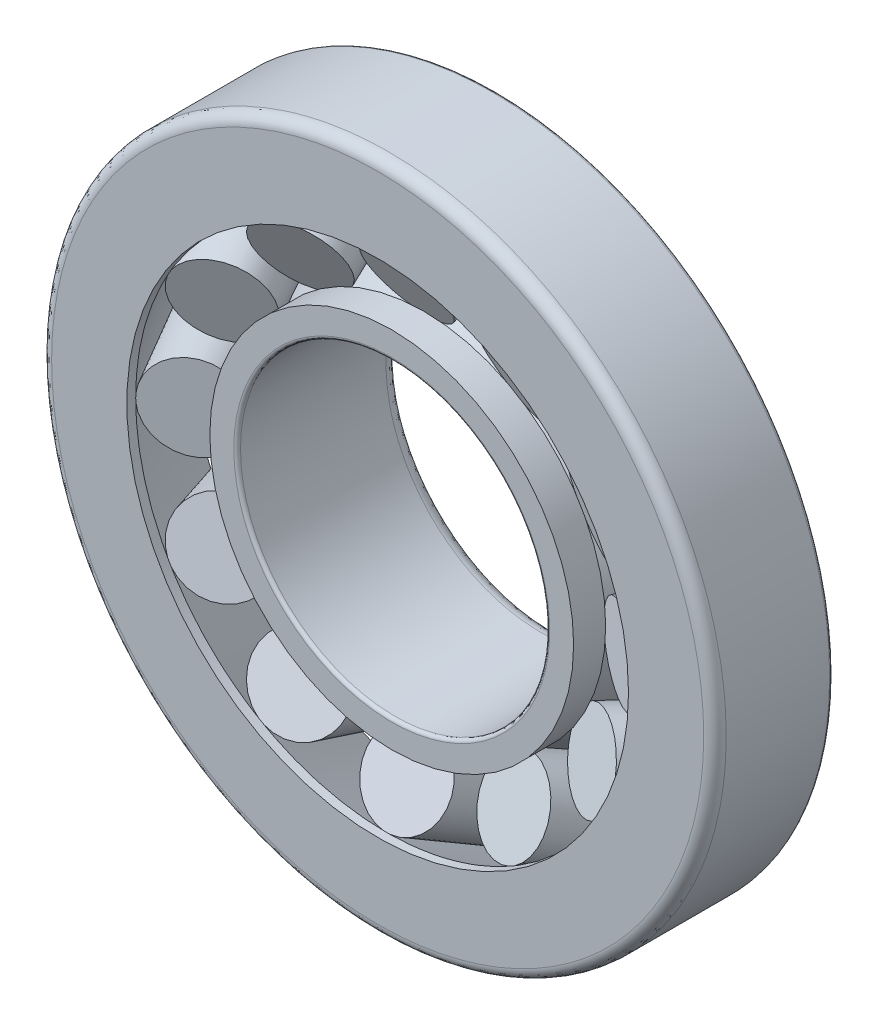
SolidWorks part; units mm, degrees
ref_plane "Front Plane" through (0, 0, 0) normal (0, 0, 1) x (1, 0, 0)
ref_plane "Top Plane" through (0, 0, 0) normal (0, 1, 0) x (1, 0, 0)
ref_plane "Right Plane" through (0, 0, 0) normal (1, 0, 0) x (0, 0, -1)
other "Configuration Table"
sketch "BaseSke" plane through (0, 0, 0) normal (1, 0, 0) x (0, 0, -1)
  line L0 (-47.2296, 0) -> (24.6132, 0) construction
  line L2 (0, 129.5214) -> (0, -86.3012) construction
  line L3 (2.5584, 53.7985) -> (-34.0584, 33.7015) construction
  line L4 (-31.5, 60) -> (-10.5, 60) construction
  line L5 (-29, 27.5) -> (0, 27.5) construction
  line L6 (-15.75, 43.75) -> (-28.7741, 67.48) construction
  line L7 (-29.925, 44.6425) -> (-12.075, 55.0565)
  line L8 (-12.075, 55.0565) -> (-8.1568, 47.9175)
  line L9 (-8.1568, 47.9175) -> (-26.2671, 37.9778)
  line L10 (-26.2671, 37.9778) -> (-29.925, 44.6425)
  line L11 (-31.5, 60) -> (-31.5, 44.625) construction
  line L12 (-29.9154, 44.625) -> (-10.5, 55.9523) construction
  line L13 (-10.5, 60) -> (-10.5, 55.9523) construction
  line L14 (-29.9154, 44.625) -> (-31.5, 44.625) construction
  line L15 (-22.6091, 31.313) -> (-4.2386, 40.7785) construction
  line L16 (-29, 27.5) -> (-29, 32.363) construction
  line L17 (-29, 32.363) -> (-23.2995, 32.363) construction
  line L18 (0, 41.8285) -> (0, 27.5) construction
  line L19 (-23.2995, 32.363) -> (-22.7221, 31.311) construction
  line L20 (-22.7221, 31.311) -> (-4.1737, 40.8682) construction
  line L21 (-4.1737, 40.8682) -> (-4.7008, 41.8285) construction
  line L22 (-4.7008, 41.8285) -> (0, 41.8285) construction
revolve "Roller" add sketch "BaseSke" angle 360 about L3
sketch "OuterRaceSke" plane through (0, 0, 0) normal (1, 0, 0) x (0, 0, -1)
  line L0 (-29.9154, 44.625) -> (-31.5, 44.625) construction
  line L1 (-29.9154, 44.625) -> (-10.5, 55.9523) construction
  line L2 (-10.5, 60) -> (-10.5, 55.9523) construction
  line L3 (-31.5, 60) -> (-10.5, 60) construction
  line L4 (-31.5, 60) -> (-31.5, 44.625) construction
  line L5 (-29.9154, 44.625) -> (-31.5, 44.625)
  line L6 (-29.9154, 44.625) -> (-10.5, 55.9523)
  line L7 (-10.5, 60) -> (-10.5, 55.9523)
  line L8 (-31.5, 60) -> (-10.5, 60)
  line L9 (-31.5, 60) -> (-31.5, 44.625)
  line L10 (-60.3939, 0) -> (35.9926, 0) construction
revolve "OuterRace" add sketch "OuterRaceSke" angle 360 about L10
sketch "InnerRaceSke" plane through (0, 0, 0) normal (1, 0, 0) x (0, 0, -1)
  line L0 (-29, 27.5) -> (0, 27.5) construction
  line L1 (-29, 27.5) -> (-29, 32.363) construction
  line L2 (-29, 32.363) -> (-23.2995, 32.363) construction
  line L3 (-23.2995, 32.363) -> (-22.7221, 31.311) construction
  line L4 (-22.7221, 31.311) -> (-4.1737, 40.8682) construction
  line L5 (-4.1737, 40.8682) -> (-4.7008, 41.8285) construction
  line L6 (-4.7008, 41.8285) -> (0, 41.8285) construction
  line L7 (0, 41.8285) -> (0, 27.5) construction
  line L8 (-29, 27.5) -> (0, 27.5)
  line L9 (-29, 27.5) -> (-29, 32.363)
  line L10 (-29, 32.363) -> (-23.2995, 32.363)
  line L11 (-23.2995, 32.363) -> (-22.7221, 31.311)
  line L12 (-22.7221, 31.311) -> (-4.1737, 40.8682)
  line L13 (-4.1737, 40.8682) -> (-4.7008, 41.8285)
  line L14 (-4.7008, 41.8285) -> (0, 41.8285)
  line L15 (0, 41.8285) -> (0, 27.5)
  line L16 (-58.1022, 0) -> (39.538, 0) construction
revolve "InnerRace" add sketch "InnerRaceSke" angle 360 about L16
fillet "Fillet1" radius 0.6 2 edges at (60, 0, 10.5) (27.5, 0, 29)
fillet "InnerFillet" radius 2.5 1 edges at (27.5, 0, 0)
fillet "OuterFillet" radius 2 1 edges at (60, 0, 31.5)
pattern_circular "CirPatternBall" count 12 over 360 about axis through (0, 0, 0) along (0, 0, 1) of "Roller"
sketch "Sketch4" plane through (0, 0, 0) normal (1, 0, 0) x (0, 0, -1)
  line L0 (-29.925, 44.6425) -> (-12.075, 55.0565)
  line L1 (-12.075, 55.0565) -> (-4.2386, 40.7785)
  line L2 (-4.2386, 40.7785) -> (-22.6091, 31.313)
  line L3 (-22.6091, 31.313) -> (-29.925, 44.6425)
  line L4 (-40.3293, 0) -> (19.5574, 0) construction
revolve "Simplified" [suppressed] add sketch "Sketch4" angle 360 about L4
equation "\"D2@BaseSke\" = \"Bearing_Thickness@BaseSke\"/2"
equation "\"D3@BaseSke\" =  ( \"Bearing_Outside_Diameter@BaseSke\" + \"Bearing_Inside_Diameter@BaseSke\" )  / 2"
equation "\"Roller_diameter@BaseSke\" = \"D3@BaseSke\"*1.02"
equation "\"D4@BaseSke\" = \"Bearing_Thickness@BaseSke\"/20"
equation "\"D5@BaseSke\" = \"Bearing_Thickness@BaseSke\" / 20"
equation "\"D8@BaseSke\" = \"Bearing_Thickness@BaseSke\"/30"
equation "\"D11@BaseSke\" = \"D8@BaseSke\""
equation "\"D1@CirPatternBall\" = int(  \"D3@BaseSke\" *  pi  /  ( \"Bearing_Outside_Diameter@BaseSke\" - \"Bearing_Inside_Diameter@BaseSke\" )  * 3) "
